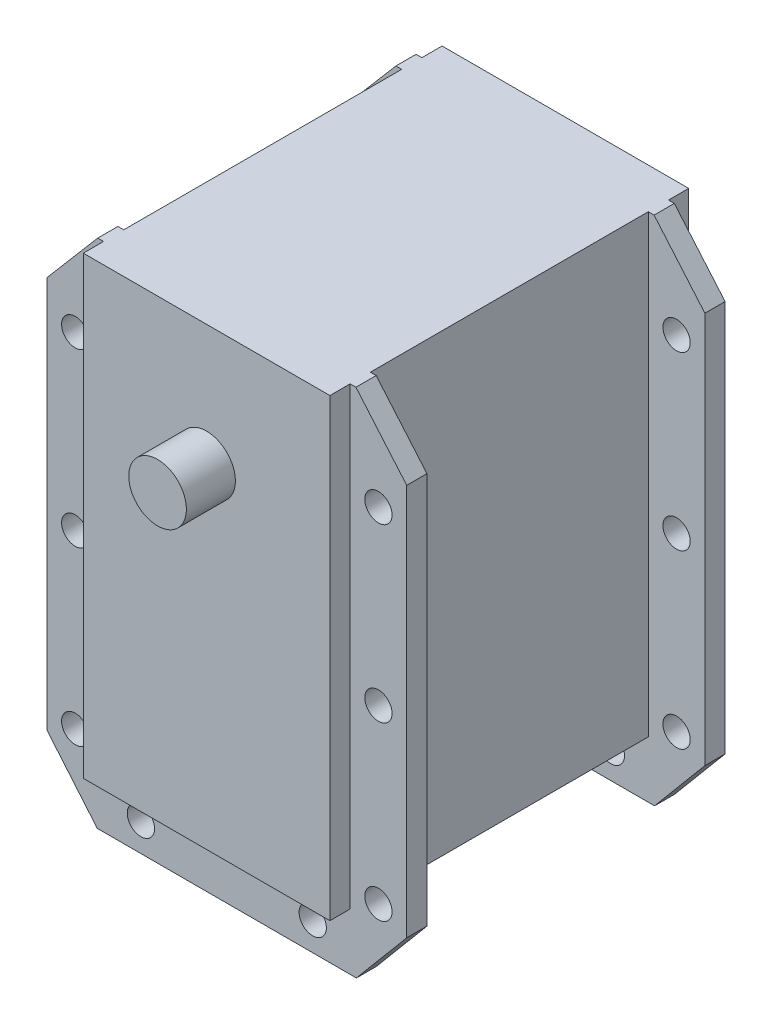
SolidWorks part; units mm, degrees
ref_plane "Front Plane" through (0, 0, 0) normal (0, 0, 1) x (1, 0, 0)
ref_plane "Top Plane" through (0, 0, 0) normal (0, 1, 0) x (1, 0, 0)
ref_plane "Right Plane" through (0, 0, 0) normal (1, 0, 0) x (0, 0, -1)
imported_body "Imported1"
sketch "Sketch1" plane through (0, 0, -17.75) normal (0, 0, -1) x (-1, 0, 0)
  circle A0 centre (0, 10.5) radius 2.85 construction
  circle A1 centre (0, 10.5) radius 2.85
extrude "Boss-Extrude1" add sketch "Sketch1" along normal blind 4.85
